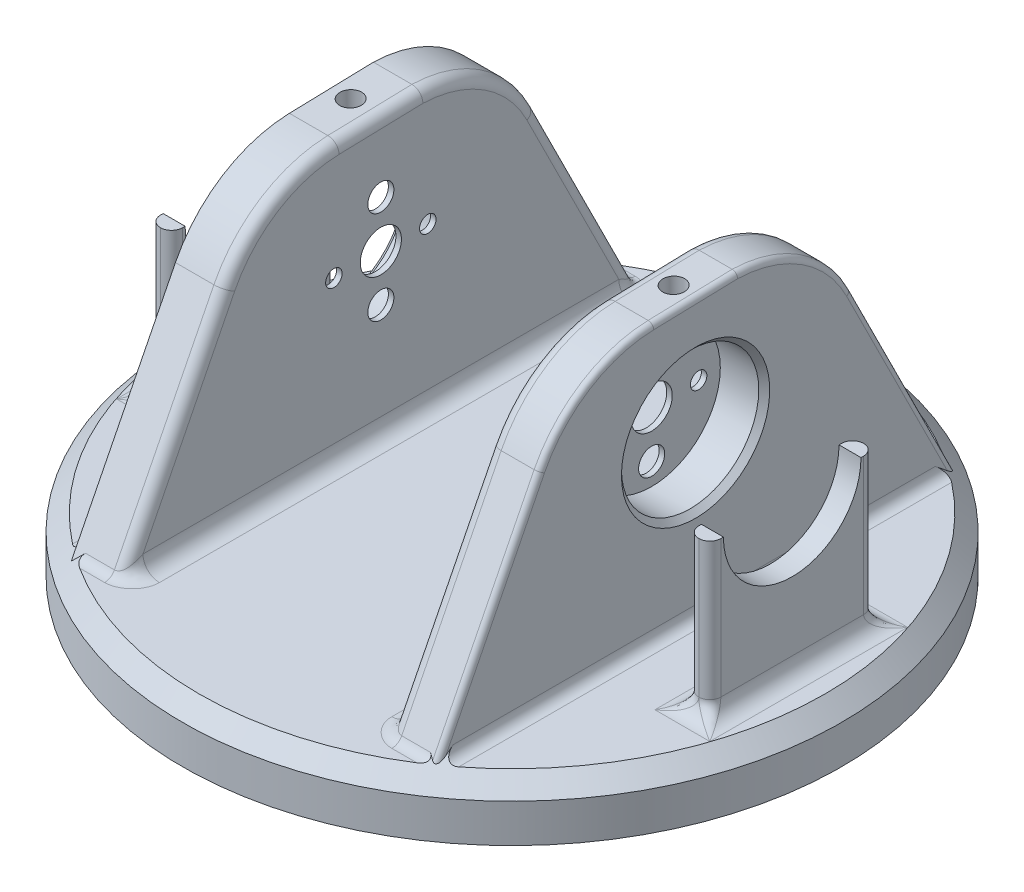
SolidWorks part; units mm, degrees
ref_plane "Front Plane" through (0, 0, 0) normal (0, 0, 1) x (1, 0, 0)
ref_plane "Top Plane" through (0, 0, 0) normal (0, 1, 0) x (1, 0, 0)
ref_plane "Right Plane" through (0, 0, 0) normal (1, 0, 0) x (0, 0, -1)
sketch "Sketch1" plane through (0, 0, 0) normal (1, 0, 0) x (0, 0, -1)
  line L6 (0, 0) -> (-4.5, 0) construction
  line L12 (-16.384, 17) -> (-35.0481, -20)
  line L13 (40.404, 17.3376) -> (59.0727, -20)
  line L14 (59.0727, -20) -> (-35.0481, -20)
  line L15 (19.6617, 30.5726) -> (4.3629, 30.1602)
  arc A4 (40.404, 17.3376) -> (19.6617, 30.5726) centre (18.9735, 6.6224) ccw
  arc A5 (-16.384, 17) -> (4.3629, 30.1602) centre (5.0084, 6.2089) cw
  circle A6 centre (12.0123, 9.1258) radius 12.5
  point P2 (24.7632, 28.984)
  point P4 (50.8987, 0)
  point P5 (0, 0)
  point P6 (12.0123, 30.3664)
  point P7 (65.971, -20)
  point P9 (12.0123, -20)
  dimension "D6" = 23.96
  dimension "D2" = 25
  dimension "D1" = 94.1208
  dimension "D9" = 37
extrude "Boss-Extrude1" add sketch "Sketch1" against normal blind 8
sketch "Sketch4" plane through (0, -20, 0) normal (0, -1, 0) x (1, 0, 0)
  line L2 (-8, 35.0481) -> (-8, -58.5523) construction
  circle A0 centre (-33.15, -11.7521) radius 60
  point P14 (-8, -11.7521)
  dimension "D2" = 120
  dimension "D1" = 25.15
extrude "Boss-Extrude2" add sketch "Sketch4" along normal blind 10
sketch "Sketch8" plane through (0, -20, 0) normal (0, 1, 0) x (1, 0, 0)
  circle A0 centre (-33.15, 11.7521) radius 2
  circle A2 centre (-33.15, 11.7521) radius 60 construction
  dimension "D1" = 4
extrude "Cut-Extrude2" cut sketch "Sketch8" against normal through all
ref_point "Point5"
ref_plane "Plane6" through (-33.15, 0, 0) normal (-1, 0, 0) x (0, 0, 1)
mirror "Mirror6" about plane through (-33.15, 0, 0) normal (-1, 0, 0) of "Boss-Extrude1"
chamfer "Chamfer2" distance 3 angle 45 1 edges at (-33.15, -20, -71.7521)
fillet "Fillet10" radius 2 1 edges at (-66.3, -20, -11.7521)
fillet "Fillet11" radius 2 1 edges at (-61.9941, -20, 35.0481)
fillet "Fillet14" radius 2 1 edges at (-61.6133, -20, -59.0727)
fillet "Fillet15" radius 2 1 edges at (-4.6867, -20, -59.0727)
fillet "Fillet25" radius 2 1 edges at (0, -20, -11.7521)
fillet "Fillet26" radius 2 1 edges at (-4.3059, -20, 35.0481)
fillet "Fillet27" radius 1 5 edges at (0, -1.99, -50.0678) (0, 26.821, -31.8615) (0, 30.3664, -12.0123) (0, 26.4417, 7.8257) (0, -1.7988, 25.8668)
sketch "Sketch10" plane through (0, -30, 0) normal (0, -1, 0) x (1, 0, 0)
  line L0 (-35.95, -11.7521) -> (-37.15, -11.7521) construction
  line L1 (-37.15, -11.7521) -> (-37.15, -4.2521)
  line L2 (-37.15, -11.7521) -> (-37.15, -19.2521)
  arc A0 (-37.15, -19.2521) -> (-37.15, -4.2521) centre (-33.15, -11.7521) ccw
  circle A1 centre (-33.15, -11.7521) radius 2.8 construction
  dimension "D1" = 17
  dimension "D2" = 5.6
  dimension "D3" = 1.2
extrude "Cut-Extrude3" cut sketch "Sketch10" against normal blind 5.3
sketch "Croquis2" plane through (-8, 0, 0) normal (-1, 0, 0) x (0, 0, 1)
  line L0 (38.8914, -20) -> (16.384, 17)
  line L1 (-4.3629, 30.1602) -> (-19.7703, 30.5692)
  line L2 (-40.404, 17.3376) -> (-58.5199, -18.8944)
  line L3 (-60.3088, -20) -> (38.8914, -20)
  arc A0 (16.384, 17) -> (-4.3629, 30.1602) centre (-7.3036, 2.5907) ccw
  arc A1 (-19.7703, 30.5692) -> (-40.404, 17.3376) centre (-16.6621, 3.018) ccw
  arc A2 (-58.5199, -18.8944) -> (-60.3088, -20) centre (-60.3088, -18) cw
  arc A3 (-19.6617, 30.5726) -> (-40.404, 17.3376) centre (-18.9735, 6.6224) ccw construction
  point P2 (-39.5027, 30.1602)
  point P17 (-19.9864, 30.561)
  point P22 (-19.7711, 30.5692)
  point P23 (-40.404, 17.3376)
extrude "Saliente-Extruir2" add sketch "Croquis2" along normal blind 1
sketch "Croquis3" plane through (-58.3, 0, 0) normal (1, 0, 0) x (0, 0, -1)
  line L0 (60.3088, -20) -> (-36.2793, -20)
  line L1 (-34.4936, -18.9008) -> (-16.384, 17)
  line L2 (4.3629, 30.1602) -> (19.6617, 30.5726)
  line L3 (40.404, 17.3376) -> (58.5199, -18.8944)
  arc A0 (-36.2793, -20) -> (-34.4936, -18.9008) centre (-37.2119, -16.4851) ccw
  arc A1 (-16.384, 17) -> (4.3629, 30.1602) centre (5.0084, 6.2089) cw
  arc A2 (19.6617, 30.5726) -> (40.404, 17.3376) centre (18.9735, 6.6224) cw
  arc A6 (60.3088, -20) -> (58.5199, -18.8944) centre (60.3088, -18) cw
extrude "Saliente-Extruir3" add sketch "Croquis3" along normal blind 1
fillet "Redondeo1" radius 2 8 edges at (-9, -19.7013, -59.2573) (-57.3, -19.7013, -59.2573) (-9, -0.7784, -49.462) (-57.3, -0.7784, -49.462) (-57.3, -0.9504, 25.4388) (-57.3, 26.4417, 7.8257) (-57.3, 30.3664, -12.0123) (-57.3, 26.821, -31.8615)
fillet "Redondeo2" radius 3 6 edges at (-57.4787, -20, -57.8447) (-8.8213, -20, -57.8447) (-57.3, -20, -12.0147) (-9, -20, -12.0147) (-8.8213, -20, 33.8152) (-57.4787, -20, 33.8152)
sketch "Croquis4" plane through (-58.3, 0, 0) normal (-1, 0, 0) x (0, 0, 1)
  circle A0 centre (-12.0123, 9.1258) radius 3.75
  dimension "D1" = 7.5
extrude "Cortar-Extruir1" cut sketch "Croquis4" against normal through all
sketch "Croquis5" plane through (-58.3, 0, 0) normal (-1, 0, 0) x (0, 0, 1)
  line L0 (-12.0123, 42.335) -> (-12.0123, -7.0833) construction
  circle A0 centre (-12.0123, 17.6258) radius 2.375
  circle A1 centre (-12.0123, 9.1258) radius 3.75 construction
  circle A2 centre (-12.0123, 0.6258) radius 2.375
  circle A3 centre (-12.0123, 9.1258) radius 3.75
  dimension "D1" = 4.75
  dimension "D3" = 8.5
  dimension "D2" = 8.5
extrude "Cortar-Extruir2" cut sketch "Croquis5" against normal through all
sketch "Croquis6" plane through (-58.3, 0, 0) normal (-1, 0, 0) x (0, 0, 1)
  line L0 (-0.6003, 9.1258) -> (-23.4243, 9.1258) construction
  circle A0 centre (-20.5623, 9.1258) radius 1.5
  circle A1 centre (-12.0123, 9.1258) radius 3.75 construction
  circle A2 centre (-12.0123, 9.1258) radius 3.75
  circle A3 centre (-3.4623, 9.1258) radius 1.5
  dimension "D1" = 3
  dimension "D2" = 8.55
  dimension "D3" = 8.55
extrude "Cortar-Extruir3" cut sketch "Croquis6" against normal through all
chamfer "Chaflán1" distance 1 angle 45 2 edges at (0, 9.1258, -24.5123) (-66.3, 9.1258, -24.5123)
sketch "Croquis8" plane through (0, -20, 0) normal (0, 1, 0) x (1, 0, 0)
  line L0 (23.85, 11.7521) -> (-90.15, 11.7521) construction
  line L1 (13.85, 26.7521) -> (17.85, 26.7521)
  line L2 (13.85, 26.7521) -> (13.85, -3.2479)
  line L3 (13.85, -3.2479) -> (17.85, -3.2479)
  line L4 (17.85, 26.7521) -> (17.85, -3.2479)
  line L5 (-84.15, 26.7521) -> (-80.15, 26.7521)
  line L6 (-84.15, 26.7521) -> (-84.15, -3.2479)
  line L7 (-84.15, -3.2479) -> (-80.15, -3.2479)
  line L8 (-80.15, 26.7521) -> (-80.15, -3.2479)
  arc A0 (2, -33.1197) -> (2, 56.6239) centre (-33.15, 11.7521) ccw construction
  point P14 (17.85, 11.7521)
  point P15 (-84.15, 11.7521)
  dimension "D1" = 30
  dimension "D2" = 4
  dimension "D3" = 6
  dimension "D4" = 6
extrude "Saliente-Extruir4" add sketch "Croquis8" along normal blind 28
sketch "Croquis9" plane through (-84.15, 0, 0) normal (-1, 0, 0) x (0, 0, 1)
  line L0 (-26.7521, 8) -> (3.2479, 8) construction
  circle A0 centre (-11.7521, 8) radius 12.5265
extrude "Cortar-Extruir5" cut sketch "Croquis9" against normal up to next and the other way through all
sketch "Croquis10" plane through (17.85, 0, 0) normal (1, 0, 0) x (0, 0, -1)
  line L0 (-3.2479, 8) -> (26.7521, 8) construction
  circle A0 centre (11.7521, 8) radius 12.5265
extrude "Cortar-Extruir6" cut sketch "Croquis10" against normal up to next
fillet "Redondeo3" radius 3 8 edges at (-82.15, -20, 3.2479) (-80.15, -20, -11.7521) (-82.15, -20, -26.7521) (-84.15, -20, -11.7521) (13.85, -20, -11.7521) (15.85, -20, -26.7521) (15.85, -20, 3.2479) (17.85, -20, -11.7521)
fillet "Redondeo5" radius 2 16 edges at (-79.2713, -19.1213, 4.1266) (-85.0287, -19.1213, 4.1266) (-79.2713, -19.1213, -27.6308) (-85.0287, -19.1213, -27.6308) (12.9713, -19.1213, -27.6308) (12.9713, -19.1213, 4.1266) (18.7287, -19.1213, -27.6308) (18.7287, -19.1213, 4.1266) (-80.15, -4.5, 3.2479) (-84.15, -4.5, 3.2479) (-80.15, -4.5, -26.7521) (-84.15, -4.5, -26.7521) (13.85, -4.5, -26.7521) (13.85, -4.5, 3.2479) (17.85, -4.5, -26.7521) (17.85, -4.5, 3.2479)
sketch "Croquis11" plane through (0, 30.0208, 0.8091) normal (0, 0.9996, 0.0269) x (1, 0, 0)
  line L1 (-1, 20.4783) -> (-1, 5.1739)
  line L2 (-66.3, 20.4783) -> (-66.3, 5.1739)
  line L3 (-1, 5.1739) -> (-7, 5.1739)
  line L4 (-59.3, 5.1739) -> (-66.3, 5.1739)
  circle A2 centre (-62.8, 12.8261) radius 2
  circle A3 centre (-4, 12.8261) radius 2
  point P8 (-4, 5.1739)
  point P14 (-1, 12.8261)
  point P16 (-66.3, 12.8261)
  point P17 (-62.8, 5.1739)
  dimension "D1" = 4
extrude "Cortar-Extruir7" cut sketch "Croquis11" against normal blind 10 contours A2 | A3
sketch "Croquis12" plane through (0, -30, 0) normal (0, -1, 0) x (1, 0, 0)
  circle A0 centre (-58.1595, -31.6991) radius 1.5
  circle A1 centre (-33.15, -11.7521) radius 2 construction
  circle A2 centre (-8.1405, -31.6991) radius 1.5
  circle A3 centre (-33.15, 20.0979) radius 1.5
  circle A4 centre (-33.15, -11.7521) radius 2
  point P8 (0, 0)
  point P9 (-33.15, 25.0816)
  point P10 (0, 0)
  dimension "D1" = 3
  dimension "D4" = 31.85
  dimension "D6" = 102.85
  dimension "D2" = 31.99
  dimension "D3" = 31.99
extrude "Cortar-Extruir8" cut sketch "Croquis12" against normal blind 9
